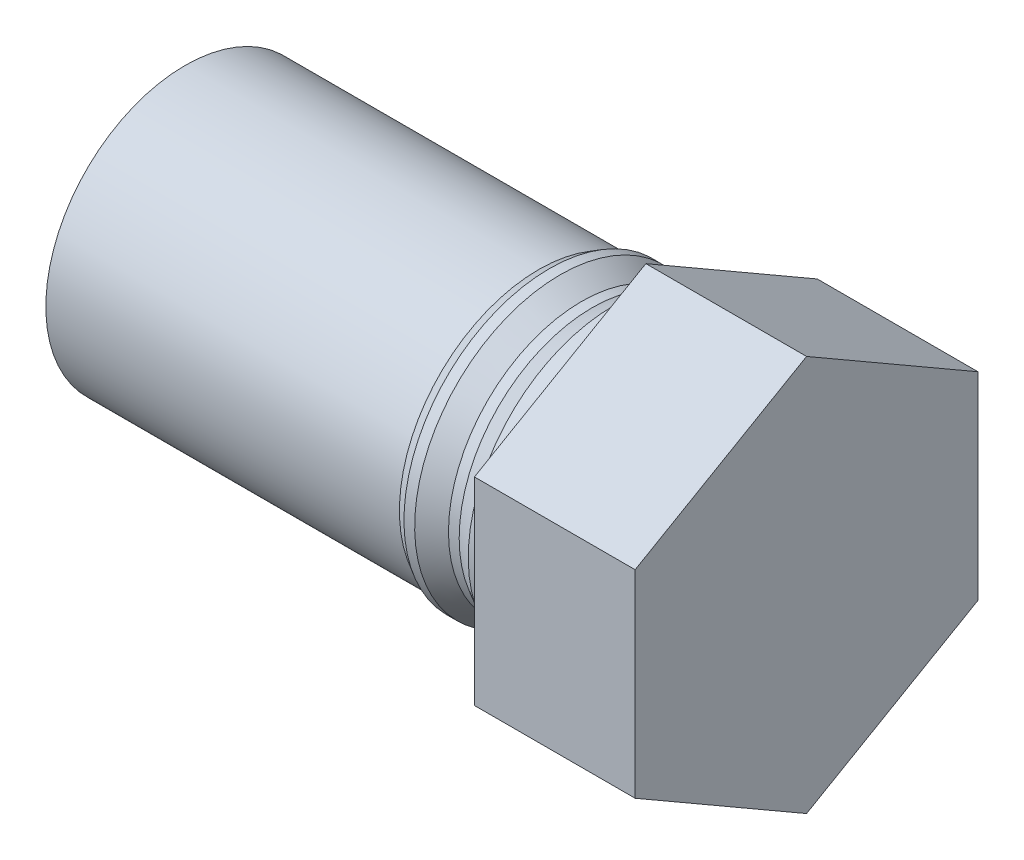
SolidWorks part; units mm, degrees
ref_plane "Alzado" through (0, 0, 0) normal (0, 0, 1) x (1, 0, 0)
ref_plane "Planta" through (0, 0, 0) normal (0, 1, 0) x (1, 0, 0)
ref_plane "Vista lateral" through (0, 0, 0) normal (1, 0, 0) x (0, 0, -1)
sketch "Croquis1" plane through (0, 0, 0) normal (0, 0, 1) x (1, 0, 0)
  line L0 (0, 0) -> (43, 0) construction
  line L1 (0, 0) -> (0, 13)
  line L2 (0, 13) -> (33, 13)
  line L3 (33, 13) -> (34, 13.5774)
  line L4 (34, 13.5774) -> (35, 13.5774)
  line L5 (34.5, 13.5774) -> (34.5, 0) construction
  line L6 (36, 13) -> (35, 13.5774)
  line L7 (36, 13) -> (37, 12.4226)
  line L8 (37, 12.4226) -> (38, 12.4226)
  line L9 (37.5, 12.4226) -> (37.5, 0) construction
  line L10 (39, 13) -> (38, 12.4226)
  line L11 (39, 13) -> (40, 13.5774)
  line L12 (40, 13.5774) -> (43, 13.5774)
  line L13 (43, 13.5774) -> (43, 0)
  line L14 (43, 0) -> (0, 0)
  dimension "D1" = 26
  dimension "D2" = 33
  dimension "D3" = 1
  dimension "D4" = 1
  dimension "D5" = 150
  dimension "D6" = 1
  dimension "D7" = 1
  dimension "D8" = 3
revolve "Revolución1" add sketch "Croquis1" angle 360 about L14
sketch "Croquis4" plane through (43, 0, 0) normal (1, 0, 0) x (0, 0, -1)
  line L1 (0, 18.4752) -> (-16, 9.2376)
  line L2 (-16, 9.2376) -> (-16, -9.2376)
  line L3 (-16, -9.2376) -> (0, -18.4752)
  line L4 (0, -18.4752) -> (16, -9.2376)
  line L5 (16, -9.2376) -> (16, 9.2376)
  line L6 (16, 9.2376) -> (0, 18.4752)
  circle A0 centre (0, 0) radius 16 construction
  dimension "D1" = 32
extrude "Saliente-Extruir3" add sketch "Croquis4" along normal blind 15
